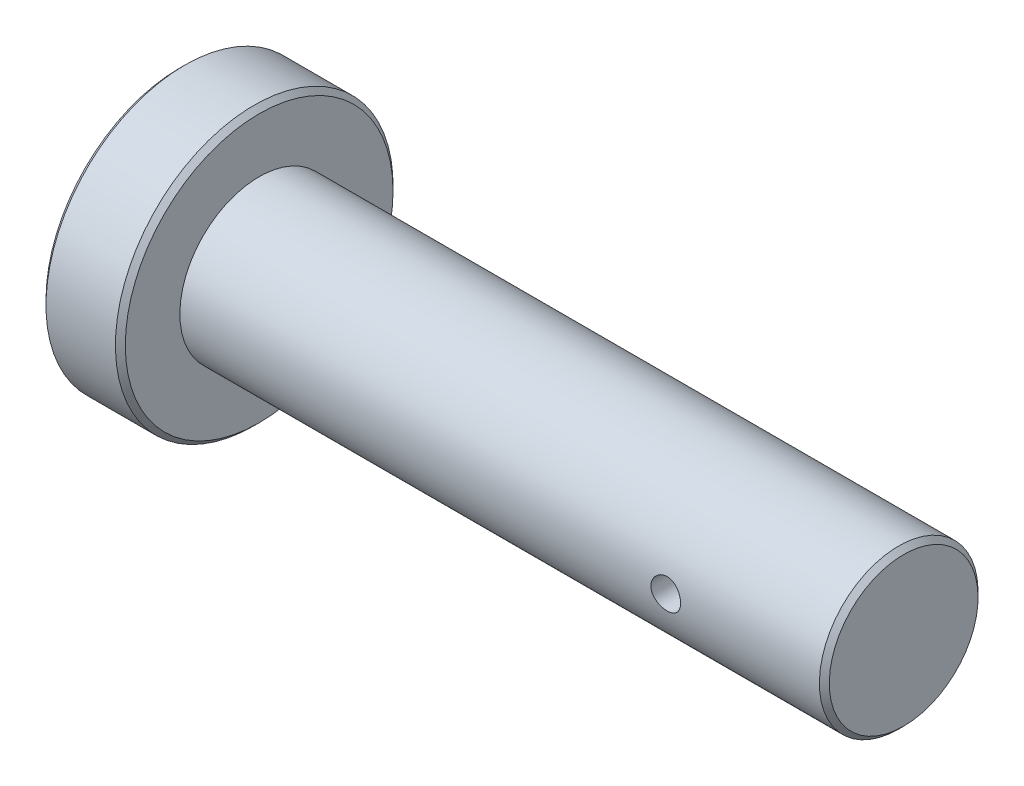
SolidWorks part; units mm, degrees
ref_plane "Front Plane" through (0, 0, 0) normal (0, 0, 1) x (1, 0, 0)
ref_plane "Top Plane" through (0, 0, 0) normal (0, 1, 0) x (1, 0, 0)
ref_plane "Right Plane" through (0, 0, 0) normal (1, 0, 0) x (0, 0, -1)
sketch "Sketch2" plane through (0, 0, 0) normal (0, 0, 1) x (1, 0, 0)
  line L0 (0, 0) -> (0, 14)
  line L1 (0, 14) -> (8, 14)
  line L2 (8, 14) -> (8, 8)
  line L3 (8, 8) -> (73, 8)
  line L4 (73, 8) -> (73, 0)
  line L5 (73, 0) -> (0, 0)
  line L6 (0, 0) -> (73, 0) construction
  dimension "D1" = 8
  dimension "D2" = 8
  dimension "D3" = 65
  dimension "D4" = 6
revolve "Revolve1" add sketch "Sketch2" angle 360 about L6
sketch "Sketch3" plane through (0, 0, 0) normal (0, 0, 1) x (1, 0, 0)
  line L0 (73, -8) -> (73, 8) construction
  circle A0 centre (57, 0) radius 1.5
  dimension "D1" = 16
  dimension "D2" = 3
extrude "Cut-Extrude1" cut sketch "Sketch3" against normal mid plane 40
chamfer "Chamfer1" distance 0.5 angle 45 3 edges at (73, -8, 0) (8, -14, 0) (0, -14, 0)
scale "Scale1" scale about centroid uniform scaling yes scale factor 0.7
scale "Scale2" scale about centroid uniform scaling yes scale factor 0.5
scale "Scale3" scale about centroid uniform scaling yes scale factor 1.25
